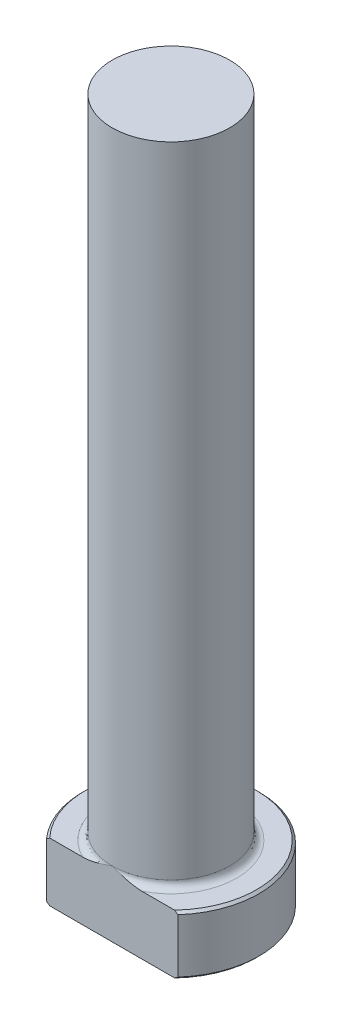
SolidWorks part; units mm, degrees
ref_plane "Front Plane" through (0, 0, 0) normal (0, 0, 1) x (1, 0, 0)
ref_plane "Top Plane" through (0, 0, 0) normal (0, 1, 0) x (1, 0, 0)
ref_plane "Right Plane" through (0, 0, 0) normal (1, 0, 0) x (0, 0, -1)
sketch "Sketch1" plane through (0, 0, 0) normal (0, 0, 1) x (1, 0, 0)
  line L0 (0, 259.9588) -> (0, -15.1925) construction
  line L1 (0, 0) -> (-9.525, 0)
  line L2 (-9.525, 0) -> (-9.525, 6.35)
  line L3 (-9.525, 6.35) -> (-6.35, 6.35)
  line L4 (-6.35, 6.35) -> (-6.35, 76.2)
  line L5 (-6.35, 76.2) -> (0, 76.2)
  line L6 (0, 76.2) -> (0, 0)
  dimension "L" = 76.2
  dimension "H" = 19.05
  dimension "T" = 6.35
  dimension "D" = 12.7
revolve "Revolve1" add sketch "Sketch1" angle 360 about L0
chamfer "Chamfer1" distance 0.254 angle 45 2 edges at (0, 6.35, 9.525) (0, 0, 9.525)
fillet "Fillet1" radius 0.762 1 edges at (0, 6.35, 6.35)
sketch "Sketch2" plane through (0, 0, 0) normal (0, 1, 0) x (1, 0, 0)
  line L0 (-7.0995, -6.35) -> (7.0995, -6.35)
  circle A0 centre (0, 0) radius 9.525 construction
  arc A1 (-7.0995, -6.35) -> (7.0995, -6.35) centre (0, 0) ccw
  circle A3 centre (0, 0) radius 6.35 construction
  dimension "D1" = 0
extrude "Key" cut sketch "Sketch2" along normal through all
sketch "Pocket Sketch" plane through (0, 0, 0) normal (0, 0, 1) x (1, 0, 0)
  line L0 (-9.9219, 0) -> (-9.9219, 6.3754)
  line L1 (-9.9219, 6.3754) -> (-7.5089, 6.3754)
  line L2 (-6.7469, 7.1374) -> (-6.7469, 22.225)
  line L3 (-6.7469, 22.225) -> (0, 22.225)
  line L4 (0, 22.225) -> (0, 0)
  line L5 (0, 0) -> (-9.9219, 0)
  line L6 (0, 12.6104) -> (0, -2.4989) construction
  line L7 (-9.525, 6.096) -> (-9.525, 0.254) construction
  line L8 (9.271, 6.35) -> (-9.271, 6.35) construction
  line L9 (-6.35, 76.2) -> (-6.35, 7.112) construction
  line L10 (-7.5089, 6.3754) -> (-6.7469, 7.1374)
  point P3 (-6.7469, 6.3754)
  dimension "D1" = 19.8437
  dimension "D2" = 0.3969
  dimension "D3" = 0.0254
  dimension "D4" = 0.3969
  dimension "D5" = 13.4937
  dimension "D6" = 22.225
